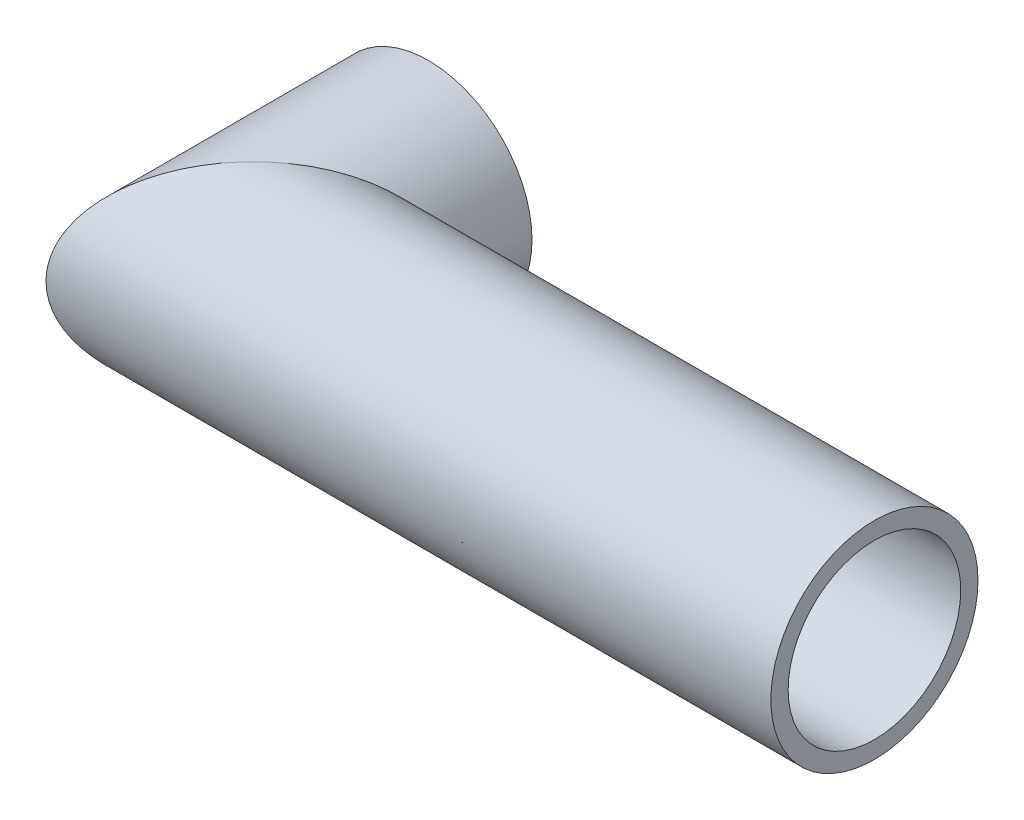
SolidWorks part; units mm, degrees
ref_plane "Alzado" through (0, 0, 0) normal (0, 0, 1) x (1, 0, 0)
ref_plane "Planta" through (0, 0, 0) normal (0, 1, 0) x (1, 0, 0)
ref_plane "Vista lateral" through (0, 0, 0) normal (1, 0, 0) x (0, 0, -1)
sketch "Croquis1" plane through (0, 0, 0) normal (0, 0, 1) x (1, 0, 0)
  circle A0 centre (0, 0) radius 6
  circle A1 centre (0, 0) radius 5
  dimension "D1" = 12
  dimension "D2" = 10
sketch "Croquis2" plane through (0, 0, 0) normal (0, 1, 0) x (1, 0, 0)
  line L0 (0, 0) -> (0, -10.16)
  line L1 (0, -10.16) -> (36, -10.16)
  dimension "D1" = 10.16
  dimension "D2" = 36
sweep "Barrer1" add profiles "Croquis1" path "Croquis2"
